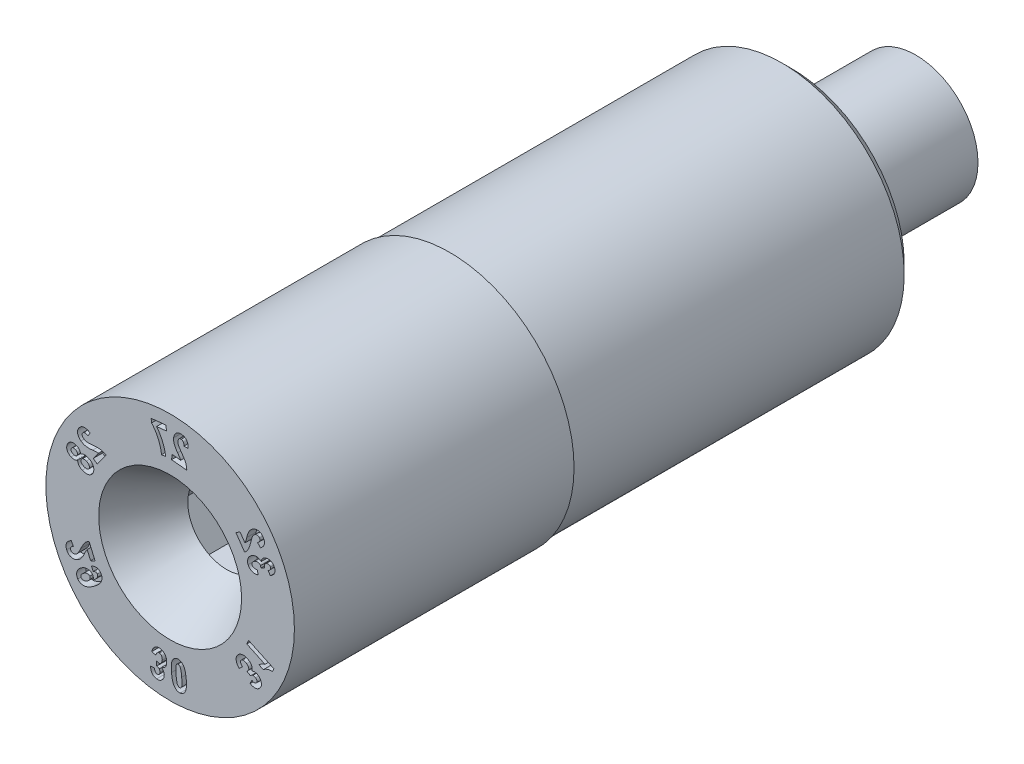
SolidWorks part; units mm, degrees
other "<M4L8-SetScrew>-<Chamfer1>"
ref_plane "Front Plane" through (0, 0, 0) normal (0, 0, 1) x (1, 0, 0)
ref_plane "Top Plane" through (0, 0, 0) normal (0, 1, 0) x (1, 0, 0)
ref_plane "Right Plane" through (0, 0, 0) normal (1, 0, 0) x (0, 0, -1)
sketch "Sketch1" plane through (0, 0, 0) normal (1, 0, 0) x (0, 0, -1)
  line L0 (1.8187, 1.25) -> (0, 2.3)
  line L2 (0, 4) -> (0, 2.3)
  line L3 (19.625, 4) -> (0, 4)
  line L4 (-3.7979, 0) -> (49996.2021, 0) construction
  line L8 (16, 1.25) -> (1.8187, 1.25)
  line L12 (20, 2) -> (20, 3.625)
  line L16 (20, 3.625) -> (19.625, 4)
  line L17 (20, 2) -> (16, 2)
  line L18 (16, 1.25) -> (16, 2)
  dimension "D1" = 20
  dimension "D2" = 45
  dimension "D3" = 0.375
  dimension "D4" = 8
  dimension "D5" = 30
  dimension "D6" = 2.3
  dimension "D7" = 2.5
  dimension "D8" = 4
  dimension "D9" = 4
revolve "Revolve1" add sketch "Sketch1" angle 360 about L4
sketch "Sketch5" plane through (0, 0, 0) normal (1, 0, 0) x (0, 0, -1)
  line L0 (0, 0) -> (50000, 0) construction
  line L1 (0, 4) -> (0, -4) construction
  line L2 (9, 3.935) -> (20, 3.935)
  line L3 (9, 3.935) -> (9, 4.935)
  line L4 (9, 4.935) -> (20, 4.935)
  line L5 (20, 3.935) -> (20, 4.935)
  line L6 (20, -3.625) -> (20, 3.625) construction
  line L7 (19.625, 4) -> (0, 4) construction
  dimension "D1" = 9
  dimension "D2" = 0.065
  dimension "D3" = 1
revolve "Cut-Revolve1" cut sketch "Sketch5" angle 360 about L0
sketch "Sketch2" plane through (0, 0, 0) normal (0, 0, 1) x (1, 0, 0)
  line L0 (0, 0) -> (0, 4) construction
  line L1 (0, 0) -> (3.4641, 2) construction
  line L2 (0, 0) -> (3.4641, -2) construction
  line L3 (0, 0) -> (0, -4) construction
  line L4 (0, 0) -> (-3.4641, -2) construction
  line L5 (0, 0) -> (-3.4641, 2) construction
  arc A0 (0.561, 2.6922) -> (1.5839, 2.2481) centre (0, 0) ccw construction
  circle A1 centre (0, 0) radius 4 construction
  text T0 "27      28      29      30      31      32" font "Arial Narrow" height 0.89
  point P19 (0, 0)
  dimension "D1" = 5.5
  dimension "D2" = 6
extrude "Cut-Extrude1" cut sketch "Sketch2" against normal blind 0.3
ref_plane "Plane1" through (0, 0, -1.8187) normal (0, 0, 1) x (1, 0, 0)
sketch "Sketch6" plane through (0, 0, -1.8187) normal (0, 0, 1) x (1, 0, 0)
  line L1 (0.7354, -1.242) -> (1.4433, 0.0159)
  line L2 (1.4433, 0.0159) -> (0.7079, 1.2579)
  line L3 (0.7079, 1.2579) -> (-0.7354, 1.242)
  line L4 (-0.7354, 1.242) -> (-1.4433, -0.0159)
  line L5 (-1.4433, -0.0159) -> (-0.7079, -1.2579)
  line L6 (-0.7079, -1.2579) -> (0.7354, -1.242)
  circle A0 centre (0, 0) radius 1.25 construction
  circle A2 centre (0, 0) radius 1.25 construction
  point P1 (0, 1.25)
extrude "Cut-Extrude2" cut sketch "Sketch6" against normal blind 2.5 contours L3 L4 L5 L6 L1 L2
inserted part "M4L8-SetScrew"
move or copy body "Body-Move/Copy2" placed by mates yes
other "Distance1" parameters "D1"=4
